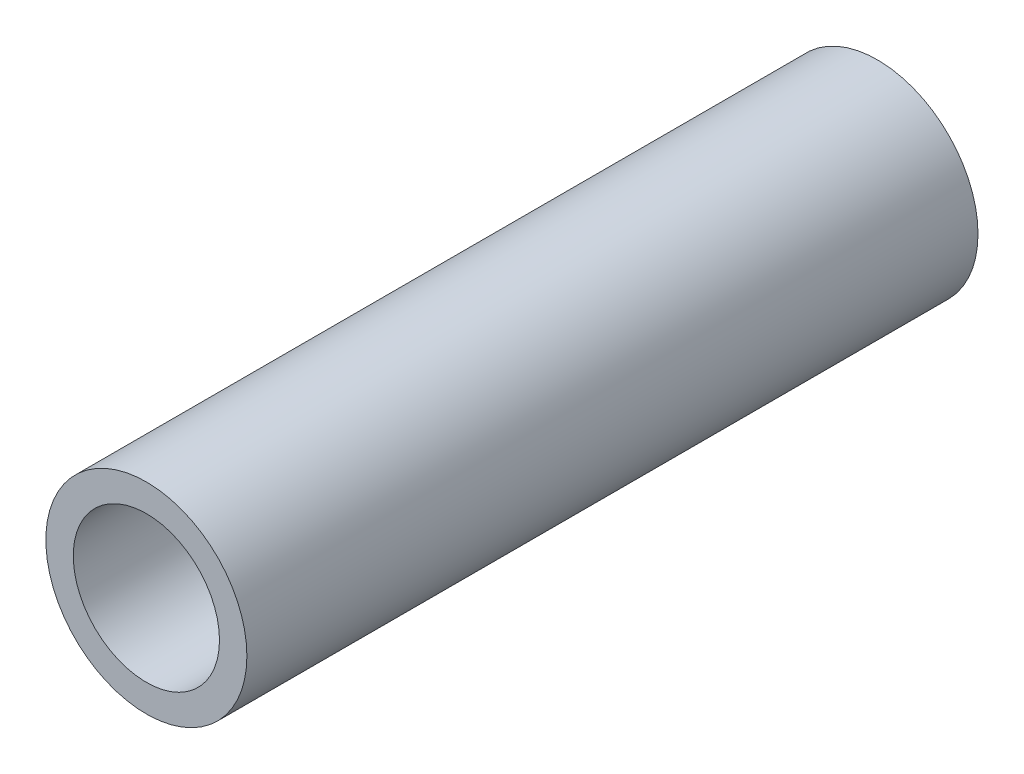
SolidWorks part; units mm, degrees
ref_plane "Front" through (0, 0, 0) normal (0, 0, 1) x (1, 0, 0)
ref_plane "Top" through (0, 0, 0) normal (0, 1, 0) x (1, 0, 0)
ref_plane "Right" through (0, 0, 0) normal (1, 0, 0) x (0, 0, -1)
sketch "Sketch1" plane through (0, 0, 0) normal (0, 0, 1) x (1, 0, 0)
  circle A0 centre (0, 0) radius 6.985
  circle A1 centre (0, 0) radius 5.08
  dimension "外径" = 13.97
  dimension "内径" = 10.16
extrude "Base-Extrude" add sketch "Sketch1" along normal blind 50.8
